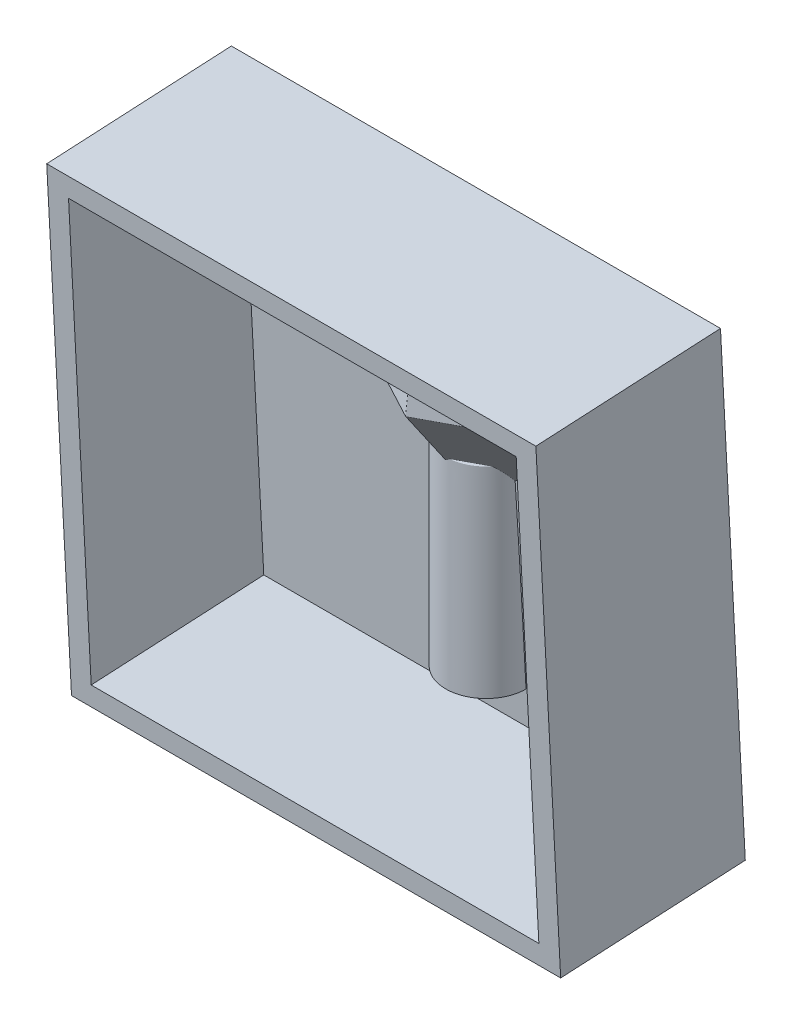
SolidWorks part; units mm, degrees
ref_plane "Alzado" through (0, 0, 0) normal (0, 0, 1) x (1, 0, 0)
ref_plane "Planta" through (0, 0, 0) normal (0, 1, 0) x (1, 0, 0)
ref_plane "Vista lateral" through (0, 0, 0) normal (1, 0, 0) x (0, 0, -1)
imported_body "Sólido importado1"
sketch "Croquis1" plane through (0, 0, 0) normal (0, 0, 1) x (1, 0, 0)
  line L0 (-41.1484, -46.2235) -> (47.1504, -46.2235) construction
ref_plane "Plano1" through (0, -0.1266, 2.4158) normal (0, -0.0523, 0.9986) x (1, 0, 0)
sketch "Croquis2" plane through (0, -0.1266, 2.4158) normal (0, -0.0523, 0.9986) x (1, 0, 0)
  line L1 (-60.8594, -58.9268) -> (60.8594, -58.9268)
  line L2 (-60.8594, -58.9268) -> (-60.8594, 58.9268)
  line L3 (-60.8594, 58.9268) -> (60.8594, 58.9268)
  line L4 (60.8594, -58.9268) -> (60.8594, 58.9268)
  line L5 (-60.8594, -58.9268) -> (60.8594, 58.9268) construction
  line L6 (-60.8594, 58.9268) -> (60.8594, -58.9268) construction
  point P0 (0, 0)
extrude "Saliente-Extruir1" add sketch "Croquis2" against normal blind 3
sketch "Croquis3" plane through (0, -0.1266, 2.4158) normal (0, -0.0523, 0.9986) x (1, 0, 0)
  line L1 (-60.8594, 58.9268) -> (60.8594, 58.9268)
  line L2 (-60.8594, 58.9268) -> (-60.8594, -58.9268)
  line L3 (-60.8594, -58.9268) -> (60.8594, -58.9268)
  line L4 (60.8594, 58.9268) -> (60.8594, -58.9268)
  line L5 (-60.8594, 58.9268) -> (60.8594, -58.9268) construction
  line L6 (-60.8594, -58.9268) -> (60.8594, 58.9268) construction
  line L7 (-55.6973, 53.9287) -> (55.6973, 53.9287)
  line L8 (-55.6973, 53.9287) -> (-55.6973, -53.9287)
  line L9 (-55.6973, -53.9287) -> (55.6973, -53.9287)
  line L10 (55.6973, 53.9287) -> (55.6973, -53.9287)
  line L11 (-55.6973, 53.9287) -> (55.6973, -53.9287) construction
  line L12 (-55.6973, -53.9287) -> (55.6973, 53.9287) construction
  point P0 (0, 0)
  point P7 (0, 0)
extrude "Saliente-Extruir2" add sketch "Croquis3" along normal blind 43
